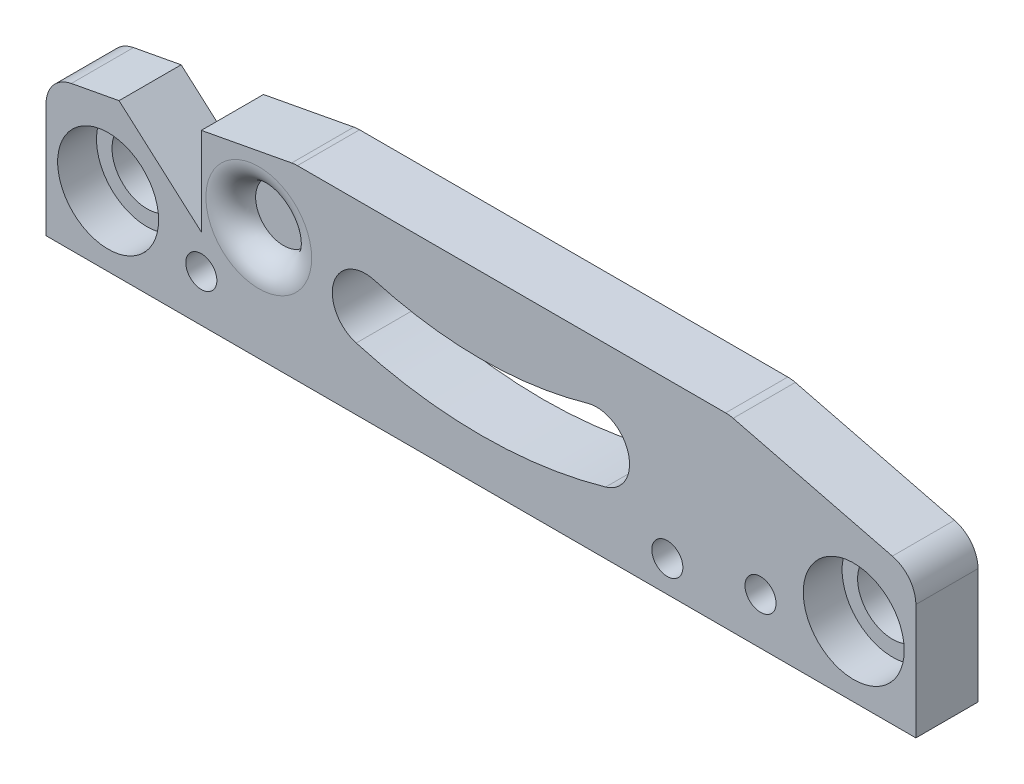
SolidWorks part; units mm, degrees
ref_plane "Front" through (0, 0, 0) normal (0, 0, 1) x (1, 0, 0)
ref_plane "Top" through (0, 0, 0) normal (0, 1, 0) x (1, 0, 0)
ref_plane "Right" through (0, 0, 0) normal (1, 0, 0) x (0, 0, -1)
sketch "Sketch1" plane through (0, 0, 0) normal (0, 0, 1) x (1, 0, 0)
  line L0 (0, 67.1585) -> (0, -46.3958) construction
  line L1 (44.45, 0) -> (-44.45, 0)
  line L2 (-44.45, 0) -> (-44.45, 19.05)
  line L3 (44.45, 0) -> (44.45, 19.05)
  line L4 (-44.45, 19.05) -> (44.45, 19.05)
  point P6 (0, 0)
  point P9 (0, 19.05)
  dimension "D1" = 88.9
  dimension "D2" = 19.05
extrude "Base-Extrude" add sketch "Sketch1" along normal blind 6.35
sketch "Sketch2" plane through (0, 0, 6.35) normal (0, 0, 1) x (1, 0, 0)
  line L0 (44.45, 14.2875) -> (25.4, 19.05)
  line L1 (44.45, 0) -> (44.45, 19.05) construction
  line L2 (-44.45, 19.05) -> (44.45, 19.05) construction
  line L3 (44.45, 0) -> (-44.45, 0) construction
  line L4 (25.4, 19.05) -> (44.45, 19.05)
  line L5 (44.45, 14.2875) -> (44.45, 19.05)
  dimension "D1" = 14.2875
  dimension "D2" = 19.05
extrude "Cut-Extrude1" cut sketch "Sketch2" against normal through all
sketch "Sketch4" plane through (0, 0, 6.35) normal (0, 0, 1) x (1, 0, 0)
  line L0 (-44.45, 14.2875) -> (-19.05, 19.05)
  line L1 (-44.45, 0) -> (-44.45, 19.05) construction
  line L2 (-44.45, 19.05) -> (25.4, 19.05) construction
  dimension "D1" = 25.4
extrude "Cut-Extrude3" cut sketch "Sketch4" against normal through all
sketch "Sketch5" plane through (0, 0, 6.35) normal (0, 0, 1) x (1, 0, 0)
  line L0 (-36.9844, 15.6873) -> (-28.575, 8.2623)
  line L1 (-44.45, 14.2875) -> (-19.05, 19.05) construction
  line L2 (-19.05, 19.05) -> (-30.473, 6.1126) construction
  line L3 (-28.575, 8.2623) -> (-28.575, 17.2641)
  line L4 (-36.9844, 15.6873) -> (-28.575, 17.2641)
  line L5 (0, 59.1462) -> (0, -3.4396) construction
  line L6 (0, -50) -> (0, 50) construction
  line L7 (44.45, 0) -> (-44.45, 0) construction
  point P6 (0, 50.8)
  dimension "D1" = 90
  dimension "D2" = 50.8
  dimension "D3" = 50.8
extrude "Cut-Extrude4" cut sketch "Sketch5" against normal through all
sketch "Sketch6" plane through (0, 0, 6.35) normal (0, 0, 1) x (1, 0, 0)
  line L0 (0, 50.8) -> (-14.5667, 0) construction
  line L1 (44.45, 0) -> (-44.45, 0) construction
  line L2 (0, 50.8) -> (14.5667, 0) construction
  line L3 (0, 65.7216) -> (0, 18.1985) construction
  line L4 (0, -50) -> (0, 50) construction
  arc A0 (-10.8847, 12.8407) -> (10.8847, 12.8407) centre (0, 50.8) ccw
  arc A2 (12.7444, 6.3552) -> (-12.7444, 6.3552) centre (0, 50.8) cw
  arc A3 (11.8145, 9.5979) -> (-11.8145, 9.5979) centre (0, 50.8) cw construction
  arc A4 (-12.7444, 6.3552) -> (-10.8847, 12.8407) centre (-11.8145, 9.5979) cw
  arc A5 (10.8847, 12.8407) -> (12.7444, 6.3552) centre (11.8145, 9.5979) cw
  point P16 (0, 11.3109)
  point P17 (0, 7.9375)
  point P18 (0, 4.5641)
  dimension "D2" = 42.8625
  dimension "D3" = 6.7469
  dimension "D1" = 32
  dimension "D4" = 3.3734
  dimension "D5" = 50.8
extrude "Cut-Extrude5" cut sketch "Sketch6" against normal through all
fillet "Fillet1" radius 3.175 4 edges at (44.45, 14.2875, 3.175) (25.4, 19.05, 3.175) (-19.05, 19.05, 3.175) (-44.45, 14.2875, 3.175)
hole_wizard "Hole1" positions "Sketch8" profile "Sketch9" legacy
sketch "Sketch8" plane through (0, 0, 6.35) normal (0, 0, 1) x (1, 0, 0)
  line L0 (0, -50) -> (0, 50) construction
  line L1 (44.45, 0) -> (-44.45, 0) construction
  point P0 (38.1, 7.1438)
  dimension "D1" = 38.1
  dimension "D2" = 7.1437
sketch "Sketch9" plane through (38.1, 7.1438, 6.35) normal (1, 0, 0) x (0, -1, 0)
  line L0 (0, 0) -> (0, 6.35)
  line L1 (0, 6.35) -> (3.5719, 6.35)
  line L2 (3.5719, 6.35) -> (3.5719, 3.9688)
  line L3 (3.5719, 3.9688) -> (5.1594, 3.9688)
  line L4 (5.1594, 3.9688) -> (5.1594, 0)
  line L5 (5.1594, 0) -> (0, 0)
  line L6 (0, 110) -> (0, -10) construction
pattern_linear "LPattern1" count 2 spacing 76.2 along (-1, 0, 0) of "Hole1"
other "Hole2"
sketch "Sketch10" plane through (0, 0, 6.35) normal (0, 0, 1) x (1, 0, 0)
  line L0 (44.45, 0) -> (-44.45, 0) construction
  line L1 (0, -50) -> (0, 50) construction
  circle A0 centre (28.575, 4.7625) radius 1.5875
  dimension "D1" = 3.175
  dimension "D2" = 4.7625
  dimension "D3" = 28.575
sketch "Sketch11" plane through (-6.4225, 2.9366, 6.35) normal (0, 0, 1) x (1, 0, 0)
  line L0 (50.8725, -2.9366) -> (-38.0275, -2.9366) construction
  line L1 (6.4225, -52.9366) -> (6.4225, 47.0634) construction
  circle A0 centre (25.4725, 0.2384) radius 1.5875
  dimension "D1" = 3.175
  dimension "D2" = 3.175
  dimension "D3" = 19.05
other "Hole3"
pattern_linear "LPattern2" count 2 spacing 57.15 along (-1, 0, 0) of "Hole2"
sketch "Sketch12" plane through (0, 0, 6.35) normal (0, 0, 1) x (1, 0, 0)
  circle A0 centre (-22.705, 11.5847) radius 2.8632
extrude "Cut-Extrude6" cut sketch "Sketch12" against normal blind 2.54
fillet "Fillet2" radius 2.54 1 edges at (-19.8418, 11.5847, 6.35)
